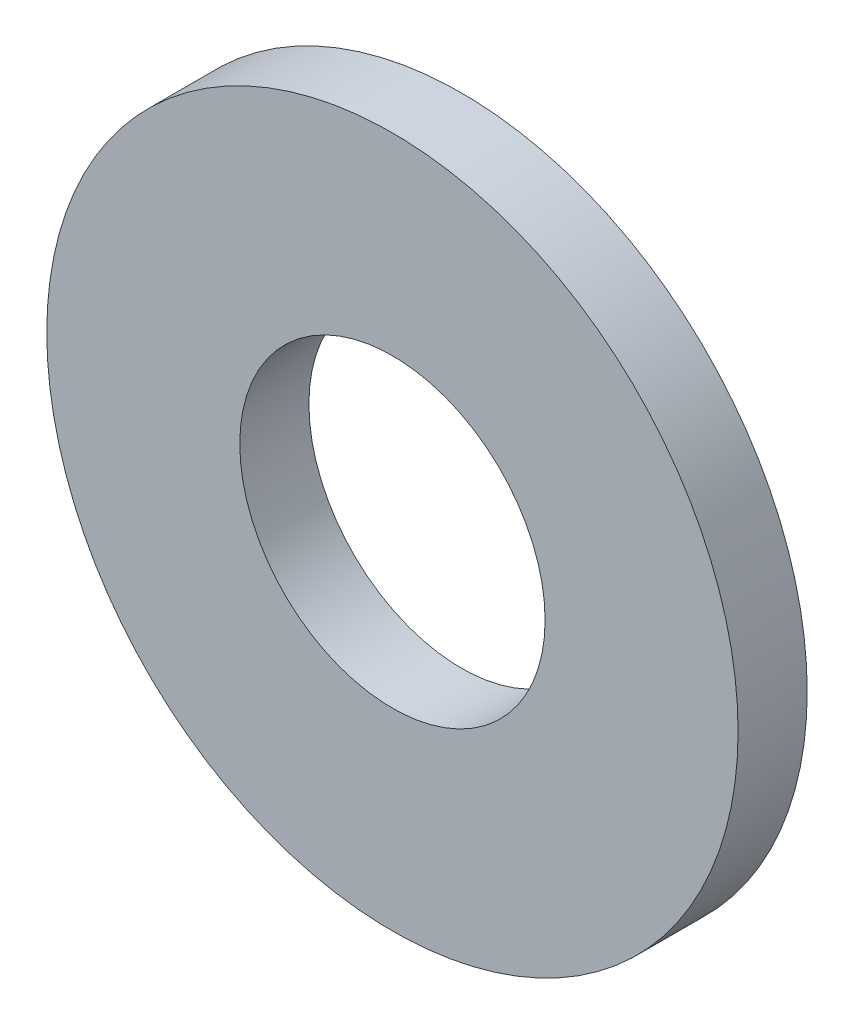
SolidWorks part; units mm, degrees
other "_TBN21-5"
ref_plane "前视基准面" through (0, 0, 0) normal (0, 0, 1) x (1, 0, 0)
ref_plane "上视基准面" through (0, 0, 0) normal (0, 1, 0) x (1, 0, 0)
ref_plane "右视基准面" through (0, 0, 0) normal (1, 0, 0) x (0, 0, -1)
imported_body "输入1"
sketch "草图1" plane through (0, 0, 1.2) normal (0, 0, 1) x (1, 0, 0)
  circle A0 centre (0, 0) radius 7.5
  circle A1 centre (0, 0) radius 6
  circle A2 centre (0, 0) radius 7.5 construction
  dimension "D1" = 1.5
extrude "切除-拉伸1" cut sketch "草图1" against normal blind 10
equation "\"Dummy1\"= \"图号代码\""
equation "\"Dummy2\"= \"名称代码\""
